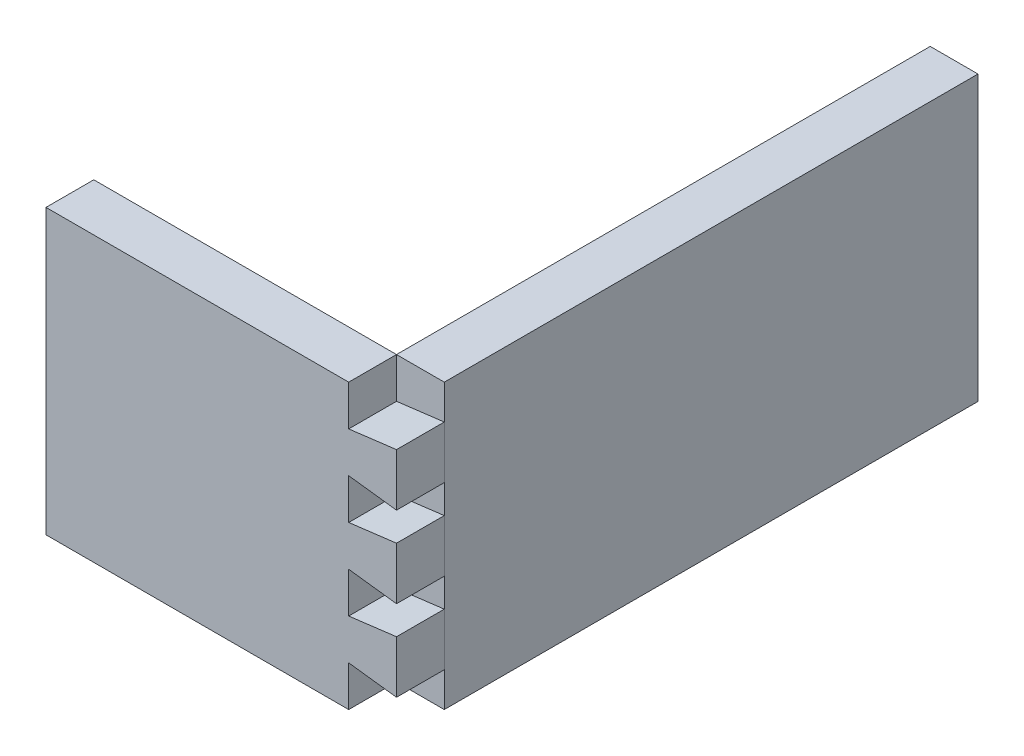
SolidWorks part; units mm, degrees
ref_plane "Piano frontale" through (0, 0, 0) normal (0, 0, 1) x (1, 0, 0)
ref_plane "Piano superiore" through (0, 0, 0) normal (0, 1, 0) x (1, 0, 0)
ref_plane "Piano destro" through (0, 0, 0) normal (1, 0, 0) x (0, 0, -1)
sketch "Schizzo1" plane through (0, 0, 0) normal (0, 0, 1) x (1, 0, 0)
  line L1 (0, 0) -> (-110, 0)
  line L2 (0, 0) -> (0, 89)
  line L3 (0, 89) -> (-110, 89)
  line L4 (-110, 0) -> (-110, 89)
extrude "Estrusione-Estrusione1" add sketch "Schizzo1" along normal blind 15 contours L4 L3 L2 L1
sketch "Schizzo2" plane through (0, 0, 0) normal (0, 0, -1) x (-1, 0, 0)
  line L0 (0, 89) -> (15, 89)
  line L1 (0, 89) -> (110, 89) construction
  line L2 (15, 89) -> (15, 76.2857)
  line L3 (15, 76.2857) -> (0, 78.1607)
  line L4 (0, 0) -> (0, 89) construction
  line L5 (0, 78.1607) -> (0, 89)
  line L6 (15, 63.5714) -> (0, 61.6964)
  line L7 (0, 61.6964) -> (0, 52.7321)
  line L8 (0, 52.7321) -> (15, 50.8571)
  line L9 (15, 50.8571) -> (15, 63.5714)
  line L10 (15, 76.2857) -> (7, 76.2857) construction
  line L11 (7, 76.2857) -> (7, 77.2857) construction
  line L12 (15, 63.5714) -> (7, 63.5714) construction
  line L13 (7, 63.5714) -> (7, 62.5714) construction
  line L14 (0, 36.2679) -> (15, 38.1429)
  line L15 (15, 38.1429) -> (15, 25.4286)
  line L16 (15, 25.4286) -> (0, 27.3036)
  line L17 (0, 27.3036) -> (0, 36.2679)
  line L18 (0, 0) -> (0, 10.8393)
  line L19 (0, 10.8393) -> (15, 12.7143)
  line L20 (15, 12.7143) -> (15, 0)
  line L21 (0, 0) -> (110, 0) construction
  line L22 (15, 0) -> (0, 0)
  point P18 (0, 0)
extrude "Taglio-Estrusione1" cut sketch "Schizzo2" against normal blind 15
sketch "Schizzo3" plane through (0, 0, 0) normal (0, 0, -1) x (-1, 0, 0)
  line L0 (15, 89) -> (110, 89) construction
  line L1 (0, 89) -> (15, 89)
  line L2 (0, 89) -> (0, 0)
  line L3 (0, 0) -> (15, 0)
  line L4 (15, 89) -> (15, 0)
  line L5 (0, 61.6964) -> (0, 78.1607) construction
  line L6 (15, 0) -> (110, 0) construction
  point P4 (5.0492, 3.0016)
extrude "Estrusione-Estrusione4" add sketch "Schizzo3" along normal blind 167.5 separate body
other "Intersecare1"
equation "\"box_height\"= 89"
equation "\"box_lenght\"= 220"
equation "\"box_depth\"= 335"
equation "\"material_thickness\"= 15"
equation "\"dovetail_slope\"= 8"
equation "\"D1@Schizzo1\"=\"box_height\""
equation "\"D2@Schizzo1\"=\"box_lenght\"/2"
equation "\"D1@Estrusione-Estrusione1\"=\"material_thickness\""
equation "\"D1@Schizzo2\"=\"material_thickness\""
equation "\"D2@Schizzo2\"=\"box_height\"/7"
equation "\"D4@Schizzo2\"=\"dovetail_slope\""
equation "\"D5@Schizzo2\"=\"box_height\"/7"
equation "\"D6@Schizzo2\"=\"box_height\"/7"
equation "\"D7@Schizzo2\"=\"dovetail_slope\""
equation "\"D9@Schizzo2\"=\"box_height\"/7"
equation "\"D10@Schizzo2\"=\"box_height\"/7"
equation "\"D11@Schizzo2\"=\"box_height\"/7"
equation "\"D1@Taglio-Estrusione1\"=\"material_thickness\""
equation "\"D1@Schizzo3\"=\"material_thickness\""
equation "\"D1@Estrusione-Estrusione4\"=\"box_depth\"/2"
